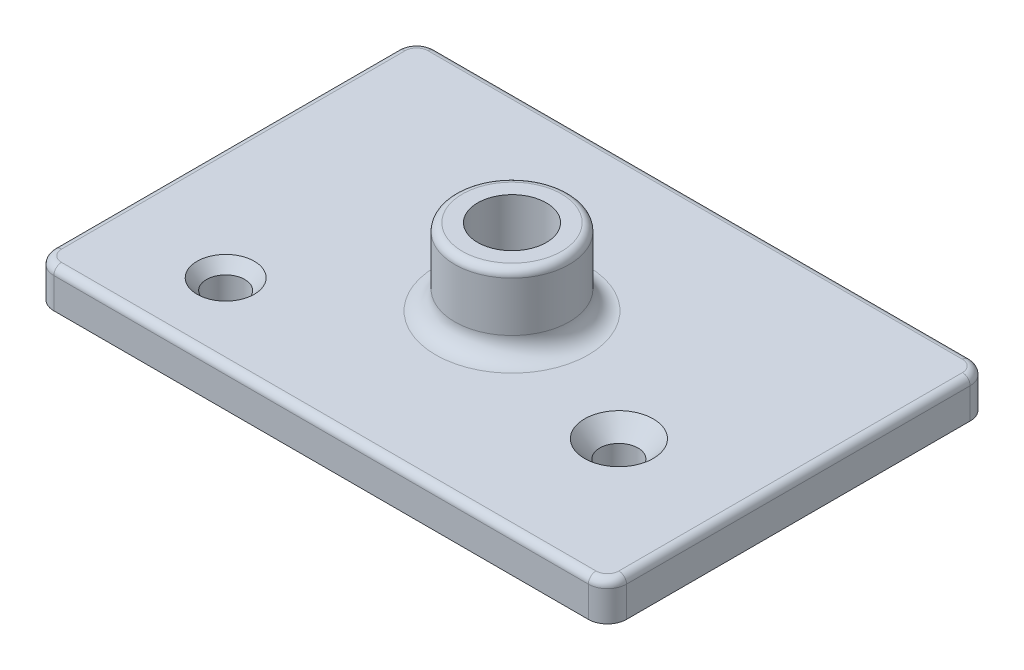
SolidWorks part; units mm, degrees
ref_plane "Front" through (0, 0, 0) normal (0, 0, 1) x (1, 0, 0)
ref_plane "Top" through (0, 0, 0) normal (0, 1, 0) x (1, 0, 0)
ref_plane "Right" through (0, 0, 0) normal (1, 0, 0) x (0, 0, -1)
sketch "Sketch1" plane through (0, 0, 0) normal (0, 1, 0) x (1, 0, 0)
  line L0 (-75, 50) -> (75, 50)
  line L1 (-75, 50) -> (-75, -50)
  line L2 (75, -50) -> (-75, -50)
  line L3 (75, -50) -> (75, 50)
  line L4 (-75, 50) -> (75, -50) construction
  dimension "D1" = 150
  dimension "D2" = 100
extrude "Base-Extrude" add sketch "Sketch1" along normal blind 10
sketch "Sketch2" plane through (0, 10, 0) normal (0, 1, 0) x (-1, 0, 0)
  circle A0 centre (0, 0) radius 15
  dimension "D1" = 30
extrude "Boss-Extrude1" add sketch "Sketch2" along normal blind 20
sketch "Sketch3" plane through (0, 30, 0) normal (0, 1, 0) x (-1, 0, 0)
  circle A0 centre (0, 0) radius 9
  dimension "D1" = 18
extrude "Cut-Extrude1" cut sketch "Sketch3" against normal blind 25
hole_wizard "Hole1" positions "Sketch7" profile "Sketch6" legacy
sketch "Sketch7" plane through (0, 10, 0) normal (0, 1, 0) x (-1, 0, 0)
  line L0 (-75, 50) -> (75, 50) construction
  line L1 (75, -50) -> (75, 50) construction
  point P0 (45, 30)
  dimension "D1" = 20
  dimension "D2" = 30
sketch "Sketch6" plane through (-45, 10, 30) normal (1, 0, 0) x (0, 0, 1)
  line L0 (0, 0) -> (0, 10)
  line L1 (0, 10) -> (5, 10)
  line L2 (5, 10) -> (5, 2.8759)
  line L3 (5, 2.8759) -> (7.5, 0)
  line L4 (7.5, 0) -> (0, 0)
  line L5 (0, -6.4453) -> (0, 115.525) construction
  line L6 (-5, 2.8759) -> (-7.5, 0) construction
  dimension "Diameter" = 10
  dimension "Depth" = 10
  dimension "C-Sink Angle" = 82
  dimension "C-Sink Diameter" = 15
hole_wizard "Hole2" positions "Sketch8" profile "Sketch9" legacy
sketch "Sketch8" plane through (87.6336, 10, -51.6071) normal (0, 1, 0) x (-1, 0, 0)
  line L3 (12.6336, 101.6071) -> (12.6336, 1.6071) construction
  line L6 (12.6336, 101.6071) -> (162.6336, 101.6071) construction
  point P0 (44.6336, 66.6071)
  dimension "D1" = 35
  dimension "D2" = 32
sketch "Sketch9" plane through (43, 10, 15) normal (1, 0, 0) x (0, 0, 1)
  line L0 (0, 0) -> (0, 10)
  line L1 (0, 10) -> (5, 10)
  line L2 (5, 10) -> (5, 4.6015)
  line L3 (5, 4.6015) -> (9, 0)
  line L4 (9, 0) -> (0, 0)
  line L5 (0, -6.4453) -> (0, 115.525) construction
  line L6 (-5, 4.6015) -> (-9, 0) construction
  dimension "Diameter" = 10
  dimension "Depth" = 10
  dimension "C-Sink Angle" = 82
  dimension "C-Sink Diameter" = 18
fillet "Fillet2" radius 5 5 edges at (0, 10, 15) (-75, 5, -50) (75, 5, -50) (75, 5, 50) (-75, 5, 50)
fillet "Fillet1" radius 2 9 edges at (0, 30, 15) (-75, 10, 0) (0, 10, 50) (75, 10, 0) (0, 10, -50) (73.5355, 10, 48.5355) (73.5355, 10, -48.5355) (-73.5355, 10, -48.5355) (-73.5355, 10, 48.5355)
